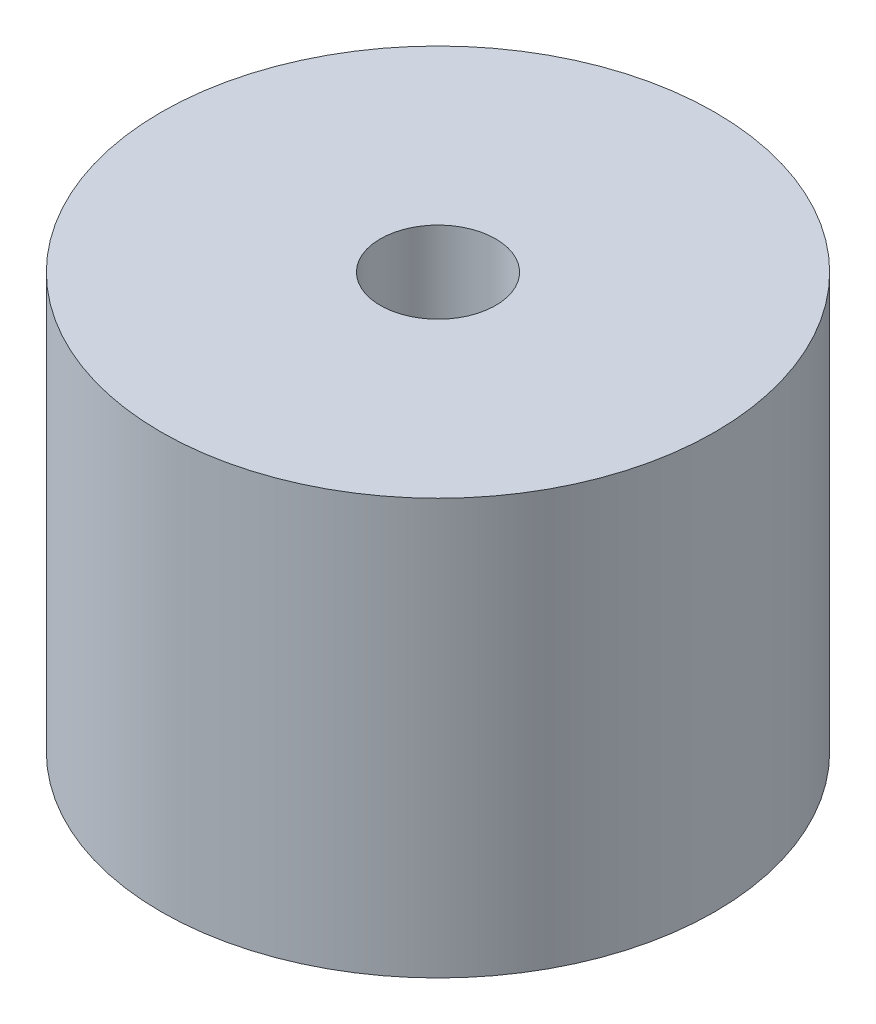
SolidWorks part; units mm, degrees
ref_plane "Plan de face" through (0, 0, 0) normal (0, 0, 1) x (1, 0, 0)
ref_plane "Plan de dessus" through (0, 0, 0) normal (0, 1, 0) x (1, 0, 0)
ref_plane "Plan de droite" through (0, 0, 0) normal (1, 0, 0) x (0, 0, -1)
sketch "Esquisse1" plane through (0, 0, 0) normal (0, 0, 1) x (1, 0, 0)
  line L0 (0.625, 17.8065) -> (3, 17.8065)
  line L1 (0.625, 14) -> (0.625, 18) construction
  line L2 (3, 17.8065) -> (3, 13.3065)
  line L3 (3, 13.3065) -> (0, 13.3065)
  line L4 (0, 13.3065) -> (0, 14)
  line L5 (-0.625, 14) -> (0.625, 14) construction
  line L6 (0, 14) -> (0.625, 14)
  line L7 (0.625, 14) -> (0.625, 17.8065)
  line L8 (0, 0) -> (0, 22.186) construction
  line L9 (1, 13.3065) -> (-1, 13.3065) construction
  dimension "D1" = 6
  dimension "D2" = 4.5
revolve "Révolution1" add sketch "Esquisse1" angle 360 about L8
sketch "Esquisse2" plane through (0, 13.3065, 0) normal (0, -1, 0) x (1, 0, 0)
  line L2 (0, 0) -> (14.8082, 0) construction
  circle A0 centre (2, 0) radius 0.5
  dimension "D1" = 1
  dimension "D2" = 2
extrude "Enlèv. mat.-Extru.1" cut sketch "Esquisse2" against normal blind 4
